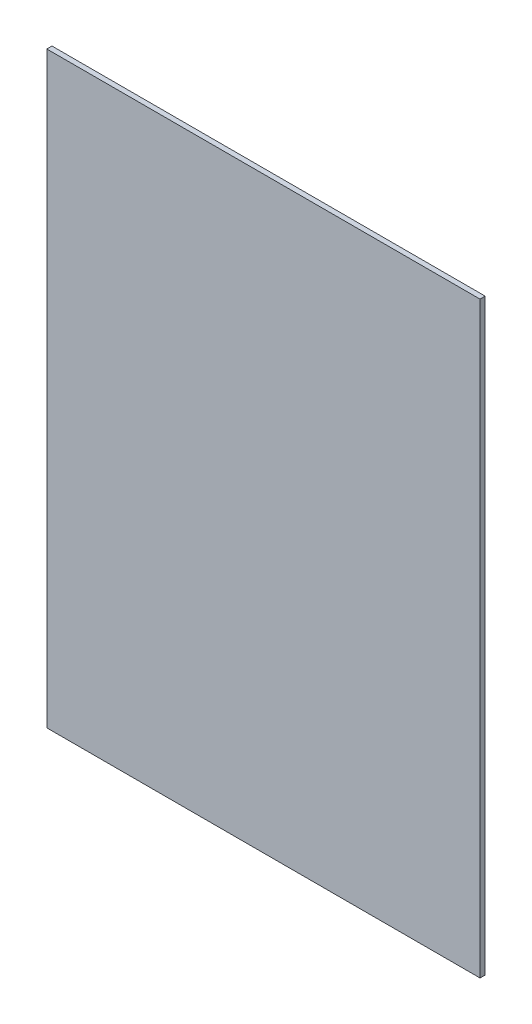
SolidWorks part; units mm, degrees
ref_plane "Piano frontale" through (0, 0, 0) normal (0, 0, 1) x (1, 0, 0)
ref_plane "Piano superiore" through (0, 0, 0) normal (0, 1, 0) x (1, 0, 0)
ref_plane "Piano destro" through (0, 0, 0) normal (1, 0, 0) x (0, 0, -1)
sketch "Schizzo1" plane through (0, 0, 0) normal (0, 0, 1) x (1, 0, 0)
  line L1 (-420, -570) -> (420, -570)
  line L2 (-420, -570) -> (-420, 570)
  line L3 (-420, 570) -> (420, 570)
  line L4 (420, -570) -> (420, 570)
  line L5 (-420, -570) -> (420, 570) construction
  line L6 (-420, 570) -> (420, -570) construction
  point P0 (0, 0)
  dimension "D1" = 840
  dimension "D2" = 1140
extrude "Estrusione-Estrusione1" add sketch "Schizzo1" along normal blind 10
